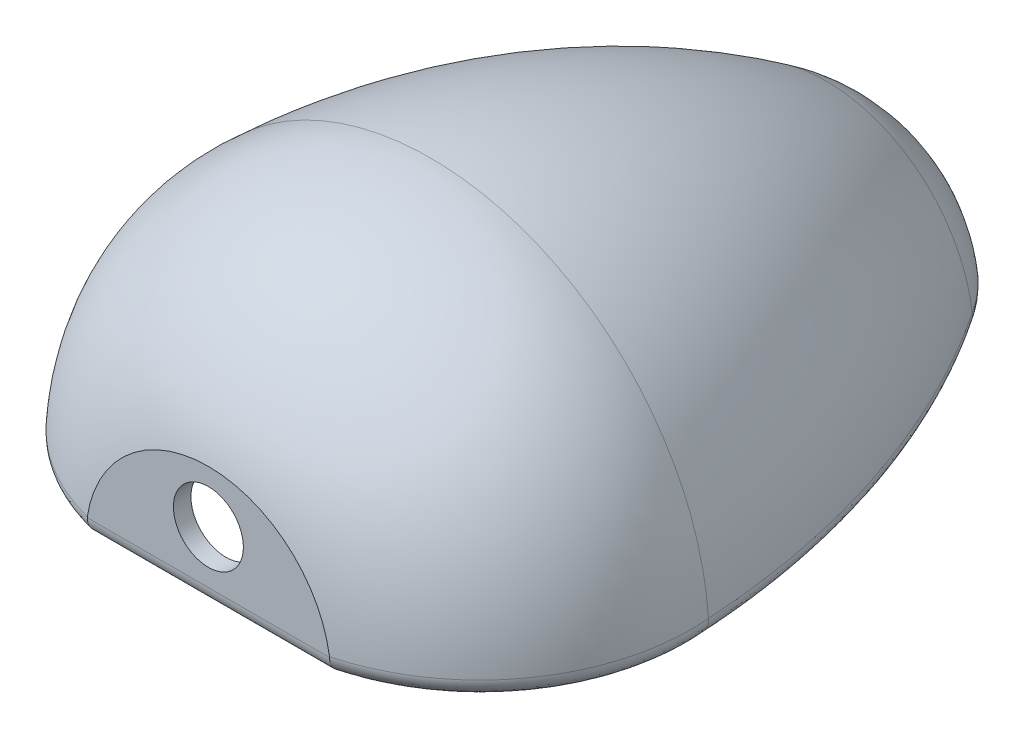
SolidWorks part; units mm, degrees
ref_plane "Alzado" through (0, 0, 0) normal (0, 0, 1) x (1, 0, 0)
ref_plane "Planta" through (0, 0, 0) normal (0, 1, 0) x (1, 0, 0)
ref_plane "Vista lateral" through (0, 0, 0) normal (1, 0, 0) x (0, 0, -1)
sketch "Croquis1" plane through (0, 0, 0) normal (0, 1, 0) x (1, 0, 0)
  line L0 (-19.7085, 0) -> (19.7085, 0)
  line L1 (80, 0) -> (-80, 0) construction
  line L2 (80, 0) -> (80, 200) construction
  line L3 (80, 200) -> (-80, 200) construction
  line L4 (-80, 0) -> (-80, 200) construction
  arc A1 (79.6066, 63.4951) -> (41.7431, 177.5229) centre (-151.6667, 50) ccw
  arc A2 (19.7085, 0) -> (79.6066, 63.4951) centre (19.7085, 60) ccw
  arc A3 (-79.6066, 63.4951) -> (-19.7085, 0) centre (-19.7085, 60) ccw
  arc A4 (-41.7431, 177.5229) -> (-79.6066, 63.4951) centre (151.6667, 50) ccw
  arc A5 (41.7431, 177.5229) -> (-41.7431, 177.5229) centre (0, 150) ccw
  point P8 (0, 0)
  dimension "D3" = 60
  dimension "D1" = 160
  dimension "D2" = 200
sketch "Croquis2" plane through (0, 0, 0) normal (1, 0, 0) x (0, 0, -1)
  line L0 (0, 0) -> (0, 40)
  line L1 (200, 0) -> (0, 0) construction
  line L2 (0, 80) -> (200, 80) construction
  line L3 (0, 0) -> (200, 0)
  arc A0 (39.2134, 79.9923) -> (0, 40) centre (40, 40) ccw
  arc A1 (192.7915, 17.5631) -> (39.2134, 79.9923) centre (43.3431, -129.9671) ccw
  arc A2 (200, 0) -> (192.7915, 17.5631) centre (175, 0) ccw
  point P9 (200, 0)
  dimension "D1" = 50
  dimension "D4" = 210
  dimension "D2" = 40
  dimension "D3" = 80
sketch "Croquis3" plane through (0, 0, 0) normal (0, 1, 0) x (1, 0, 0)
  line L0 (-19.7085, 0) -> (19.7085, 0) construction
  line L1 (-35, 0) -> (0, 0)
  line L2 (0, 0) -> (0, 200)
  arc A3 (0, 200) -> (-42.0155, 176.7026) centre (0.2575, 150.0007) ccw
  arc A4 (-42.0155, 176.7026) -> (-79.6066, 63.4951) centre (150.0028, 50.0971) ccw
  arc A5 (-79.6066, 63.4951) -> (-35, 0) centre (-19.8536, 58.0567) ccw
  dimension "D2" = 60
  dimension "D3" = 230
  dimension "D4" = 50
  dimension "D1" = 35
sketch "Croquis4" plane through (0, 0, 0) normal (0, 1, 0) x (1, 0, 0)
  line L0 (-19.7085, 0) -> (19.7085, 0) construction
  line L1 (0, 0) -> (19.7085, 0)
  line L2 (0, 0) -> (0, 200)
  arc A0 (41.7431, 177.5229) -> (-41.7431, 177.5229) centre (0, 150) ccw construction
  arc A1 (79.6066, 63.4951) -> (41.7431, 177.5229) centre (-151.6667, 50) ccw construction
  arc A2 (19.7085, 0) -> (79.6066, 63.4951) centre (19.7085, 60) ccw construction
  arc A3 (41.7431, 177.5229) -> (0, 200) centre (0, 150) ccw
  arc A4 (79.6066, 63.4951) -> (41.7431, 177.5229) centre (-151.6667, 50) ccw
  arc A5 (19.7085, 0) -> (79.6066, 63.4951) centre (19.7085, 60) ccw
revolve "Revolución1" add sketch "Croquis3" angle 180 about L1
sketch "Croquis5" plane through (0, 0, 0) normal (0, 1, 0) x (1, 0, 0)
  line L0 (0, 5) -> (19.7085, 5)
  line L1 (0, 5) -> (0, 192)
  line L2 (0, 0) -> (19.7085, 0)
  line L3 (0, 200) -> (0, 0)
  line L4 (0, 0) -> (19.7085, 0) construction
  arc A0 (19.7085, 5) -> (74.6151, 58.2039) centre (19.6444, 60) ccw
  arc A1 (74.6151, 58.2039) -> (37.5688, 169.7706) centre (-151.6667, 45) ccw
  arc A2 (37.5688, 169.7706) -> (0, 192) centre (-1.2551, 147.0175) ccw
  arc A3 (19.7085, 0) -> (79.6066, 63.4951) centre (19.7085, 60) ccw
  arc A4 (79.6066, 63.4951) -> (41.7431, 177.5229) centre (-151.6667, 50) ccw
  arc A5 (41.7431, 177.5229) -> (0, 200) centre (0, 150) ccw
  arc A6 (19.7085, 0) -> (79.6066, 63.4951) centre (19.7085, 60) ccw construction
  arc A7 (79.6066, 63.4951) -> (41.7431, 177.5229) centre (-151.6667, 50) ccw construction
  arc A8 (41.7431, 177.5229) -> (0, 200) centre (0, 150) ccw construction
  dimension "D2" = 8
  dimension "D4" = 5
  dimension "D3" = 5
  dimension "D1" = 0
sketch "Croquis6" plane through (0, 0, 0) normal (0, 0, 1) x (1, 0, 0)
  circle A0 centre (0, 20) radius 10
  dimension "D1" = 20
  dimension "D2" = 20
fillet "Redondeo6" radius 5 8 edges at (0, 42.0155, -176.7026) (68.2779, 0, -122.5783) (-68.2779, 0, -122.5783) (68.9493, 0, -23.566) (-68.9493, 0, -23.566) (0, 0, 0) (23.9892, 0, -193.7282) (-23.9892, 0, -193.7282)
sketch "Croquis7" plane through (0, 0, 0) normal (0, -1, 0) x (1, 0, 0)
  line L1 (0, -194.6925) -> (0, -5)
  line L3 (33.9784, -5) -> (-33.9784, -5)
  line L4 (33.9784, -5) -> (0, -5)
  spline S6 degree 3 poles (543.2606, 640.0947) (30.0101, 91.4426) (-86.105, -115.7605) (-33.0193, -179.9323) (-31.7506, -181.2857) (-29.7148, -183.2018) (-29.0121, -183.8229) (-27.5739, -185.0157) (-26.838, -185.5881) (-24.58, -187.2338) (-23.0075, -188.2364) (-19.7297, -190.0468) (-18.0515, -190.84) (-14.6193, -192.2105) (-12.8654, -192.7879) (-10.1772, -193.4907) (-9.2715, -193.6976) (-7.4406, -194.0555) (-6.5145, -194.2064) (69.934, -204.1751) (162.1276, -18.1202) (304.5201, 757.8113) knots -5.365898 -5.365898 -5.365898 -5.365898 0.125 0.125 0.25 0.25 0.3125 0.3125 0.375 0.375 0.5 0.5 0.625 0.625 0.75 0.75 0.8125 0.8125 0.875 0.875 5.970876 5.970876 5.970876 5.970876 only from (-37.4817, -173.9919) to (0, -194.6925)
  spline S7 degree 3 poles (-731.4823, 3726.8494) (-312.0691, 378.4045) (-127.3949, -211.6679) (6.5145, -194.2064) (7.4406, -194.0555) (9.2715, -193.6976) (10.1772, -193.4907) (12.8654, -192.7879) (14.6193, -192.2105) (18.0515, -190.84) (19.7297, -190.0468) (23.0075, -188.2364) (24.58, -187.2338) (26.838, -185.5881) (27.5739, -185.0157) (29.0121, -183.8229) (29.7148, -183.2018) (31.7506, -181.2857) (33.0193, -179.9323) (128.0189, -65.0937) (-327.1059, 520.2866) (-2684.2034, 2740.945) knots -8.848059 -8.848059 -8.848059 -8.848059 0.125 0.125 0.1875 0.1875 0.25 0.25 0.375 0.375 0.5 0.5 0.625 0.625 0.6875 0.6875 0.75 0.75 0.875 0.875 10.799927 10.799927 10.799927 10.799927 only from (0, -194.6925) to (37.4817, -173.9919)
  spline S8 degree 3 poles (-3835.6852, 574.9331) (-997.3599, -418.434) (-101.8755, -464.2116) (56.4725, -139.5321) (60.1985, -130.4188) (66.4637, -111.6134) (68.9482, -102.0845) (141.9988, 278.2495) (-718.0238, 827.6486) (-3434.9281, 1733.4095) knots -8.692356 -8.692356 -8.692356 -8.692356 0.25 0.25 0.5 0.5 0.75 0.75 10.354095 10.354095 10.354095 10.354095 only from (37.4817, -173.9919) to (74.4522, -63.1215)
  spline S9 degree 3 poles (-3836.7071, -827.2621) (-679.5995, -444.9103) (88.6183, -222.9425) (74.3639, -51.9047) (74.1614, -50.3151) (73.7514, -47.9377) (73.597, -47.1465) (73.2522, -45.5664) (73.0619, -44.7785) (72.0304, -40.8858) (70.9448, -37.8877) (68.2724, -32.1147) (66.6857, -29.3398) (63.9093, -25.3541) (62.9304, -24.0741) (60.8761, -21.6171) (59.7997, -20.4385) (56.4244, -17.0506) (53.9808, -14.9878) (50.6746, -12.6641) (50.001, -12.2126) (48.6422, -11.3444) (47.9554, -10.9266) (45.8727, -9.7209) (44.4549, -8.9809) (-112.974, 64.7055) (-603.5088, -589.0015) (-2079.451, -3383.2138) knots -6.517451 -6.517451 -6.517451 -6.517451 0.125 0.125 0.1875 0.1875 0.21875 0.21875 0.25 0.25 0.375 0.375 0.5 0.5 0.5625 0.5625 0.625 0.625 0.75 0.75 0.78125 0.78125 0.8125 0.8125 0.875 0.875 7.613621 7.613621 7.613621 7.613621 only from (74.4522, -63.1215) to (33.9784, -5)
  spline S10 degree 3 poles (615.5041, -765.3713) (226.3862, -144.5797) (42.0028, 31.4867) (-44.4549, -8.9809) (-45.8727, -9.7209) (-47.9554, -10.9266) (-48.6422, -11.3444) (-50.001, -12.2126) (-50.6746, -12.6641) (-53.9808, -14.9878) (-56.4244, -17.0506) (-59.7997, -20.4385) (-60.8761, -21.6171) (-62.9304, -24.0741) (-63.9093, -25.3541) (-66.6857, -29.3398) (-68.2724, -32.1147) (-70.9448, -37.8877) (-72.0304, -40.8858) (-73.0619, -44.7785) (-73.2522, -45.5664) (-73.597, -47.1465) (-73.7514, -47.9377) (-74.1614, -50.3151) (-74.3639, -51.9047) (-82.2242, -146.2192) (144.3061, -254.6668) (868.3282, -396.5148) knots -3.547581 -3.547581 -3.547581 -3.547581 0.125 0.125 0.1875 0.1875 0.21875 0.21875 0.25 0.25 0.375 0.375 0.4375 0.4375 0.5 0.5 0.625 0.625 0.75 0.75 0.78125 0.78125 0.8125 0.8125 0.875 0.875 4.509776 4.509776 4.509776 4.509776 only from (-33.9784, -5) to (-74.4522, -63.1215)
  spline S11 degree 3 poles (649.4098, 626.821) (93.909, 326.5334) (-106.679, 94.3585) (-68.9482, -102.0845) (-66.4637, -111.6134) (-60.1985, -130.4188) (-56.4725, -139.5321) (27.9274, -312.587) (308.4657, -379.048) (958.3233, -265.3794) knots -4.589652 -4.589652 -4.589652 -4.589652 0.25 0.25 0.5 0.5 0.75 0.75 5.399548 5.399548 5.399548 5.399548 only from (-74.4522, -63.1215) to (-37.4817, -173.9919)
  spline S13 degree 3 poles (0, -194.6925) (1.8731, -194.6925) (3.7357, -194.5688) (6.5145, -194.2064) (7.4406, -194.0555) (9.2715, -193.6976) (10.1772, -193.4907) (12.8654, -192.7879) (14.6193, -192.2105) (18.0515, -190.84) (19.7297, -190.0468) (23.0075, -188.2364) (24.58, -187.2338) (26.838, -185.5881) (27.5739, -185.0157) (29.0121, -183.8229) (29.7148, -183.2018) (31.7506, -181.2857) (33.0193, -179.9323) (35.3825, -177.0756) (36.477, -175.5723) (37.4817, -173.9919) knots 0 0 0 0 0.125 0.125 0.1875 0.1875 0.25 0.25 0.375 0.375 0.5 0.5 0.625 0.625 0.6875 0.6875 0.75 0.75 0.875 0.875 1 1 1 1
  spline S14 degree 3 poles (37.4817, -173.9919) (42.9735, -165.7399) (47.8595, -157.1924) (56.4725, -139.5321) (60.1985, -130.4188) (66.4637, -111.6134) (68.9482, -102.0845) (72.6549, -82.7862) (73.8772, -73.016) (74.4522, -63.1215) knots 0 0 0 0 0.25 0.25 0.5 0.5 0.75 0.75 1 1 1 1
  spline S15 degree 3 poles (74.4522, -63.1215) (74.7512, -59.8949) (74.7626, -56.6877) (74.3639, -51.9047) (74.1614, -50.3151) (73.7514, -47.9377) (73.597, -47.1465) (73.2522, -45.5664) (73.0619, -44.7785) (72.0304, -40.8858) (70.9448, -37.8877) (68.2724, -32.1147) (66.6857, -29.3398) (63.9093, -25.3541) (62.9304, -24.0741) (60.8761, -21.6171) (59.7997, -20.4385) (56.4244, -17.0506) (53.9808, -14.9878) (50.6746, -12.6641) (50.001, -12.2126) (48.6422, -11.3444) (47.9554, -10.9266) (45.8727, -9.7209) (44.4549, -8.9809) (40.1148, -6.9494) (37.1062, -5.8452) (33.9784, -5) knots 0 0 0 0 0.125 0.125 0.1875 0.1875 0.21875 0.21875 0.25 0.25 0.375 0.375 0.5 0.5 0.5625 0.5625 0.625 0.625 0.75 0.75 0.78125 0.78125 0.8125 0.8125 0.875 0.875 1 1 1 1
  dimension "D1" = 0
revolve "Cortar-Revolución1" cut sketch "Croquis7" angle 360 about L1
extrude "Cortar-Extruir1" cut sketch "Croquis6" against normal blind 25
